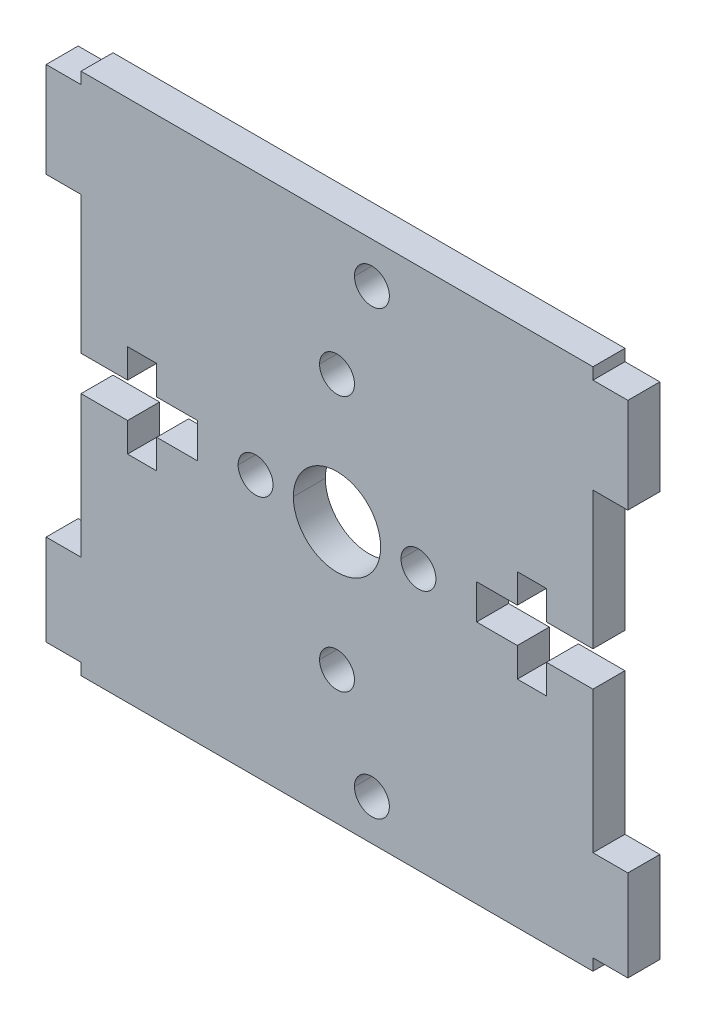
SolidWorks part; units mm, degrees
ref_plane "Front Plane" through (0, 0, 0) normal (0, 0, 1) x (1, 0, 0)
ref_plane "Top Plane" through (0, 0, 0) normal (0, 1, 0) x (1, 0, 0)
ref_plane "Right Plane" through (0, 0, 0) normal (1, 0, 0) x (0, 0, -1)
imported_body "Imported1"
sketch "Sketch1" plane through (0, 0, 0) normal (0, 0, 1) x (1, 0, 0)
  line L1 (-69.01, -74.6744) -> (-66.01, -74.6744)
  line L2 (-69.01, -74.6744) -> (-69.01, -101.6744)
  line L3 (-69.01, -101.6744) -> (-66.01, -101.6744)
  line L4 (-66.01, -74.6744) -> (-66.01, -101.6744)
  line L5 (-19, -74.6744) -> (-22.01, -74.6744)
  line L6 (-19, -74.6744) -> (-19, -101.6744)
  line L7 (-19, -101.6744) -> (-22.01, -101.6744)
  line L8 (-22.01, -74.6744) -> (-22.01, -101.6744)
  line L9 (-19.0081, -110.4966) -> (-22.0081, -110.4966)
  line L10 (-19.0081, -110.4966) -> (-19.0081, -109.4966)
  line L11 (-19.0081, -109.4966) -> (-22.0081, -109.4966)
  line L12 (-22.0081, -110.4966) -> (-22.0081, -109.4966)
  line L13 (-19.0081, -65.4966) -> (-22.0081, -65.4966)
  line L14 (-19.0081, -65.4966) -> (-19.0081, -66.4966)
  line L15 (-19.0081, -66.4966) -> (-22.0081, -66.4966)
  line L16 (-22.0081, -65.4966) -> (-22.0081, -66.4966)
  line L17 (-69.0081, -65.4966) -> (-66.0081, -65.4966)
  line L18 (-69.0081, -65.4966) -> (-69.0081, -66.4966)
  line L19 (-69.0081, -66.4966) -> (-66.0081, -66.4966)
  line L20 (-66.0081, -65.4966) -> (-66.0081, -66.4966)
  line L21 (-69.0081, -110.4966) -> (-66.0081, -110.4966)
  line L22 (-69.0081, -110.4966) -> (-69.0081, -109.4966)
  line L23 (-69.0081, -109.4966) -> (-66.0081, -109.4966)
  line L24 (-66.0081, -110.4966) -> (-66.0081, -109.4966)
extrude "Cut-Extrude1" cut sketch "Sketch1" along normal blind 3
sketch "Sketch3" plane through (0, 0, 0) normal (0, 0, 1) x (1, 0, 0)
  line L1 (-62.01, -84) -> (-59.51, -84)
  line L2 (-62.01, -84) -> (-62.01, -92)
  line L3 (-62.01, -92) -> (-59.51, -92)
  line L4 (-59.51, -84) -> (-59.51, -92)
  line L5 (-28.51, -84) -> (-26.01, -84)
  line L6 (-28.51, -84) -> (-28.51, -92)
  line L7 (-28.51, -92) -> (-26.01, -92)
  line L8 (-26.01, -84) -> (-26.01, -92)
extrude "Cut-Extrude3" cut sketch "Sketch3" along normal blind 3
sketch "Sketch4" plane through (0, 0, 0) normal (1, 0, 0) x (0, 0, -1)
  line L0 (-3, -110.4966) -> (0, -110.4966) construction
  line L1 (-3, -65.4966) -> (-2.75, -65.4966)
  line L2 (-3, -65.4966) -> (-3, -110.4966)
  line L3 (-3, -110.4966) -> (-2.75, -110.4966)
  line L4 (-2.75, -65.4966) -> (-2.75, -110.4966)
extrude "Cut-Extrude4" cut sketch "Sketch4" against normal blind 75
